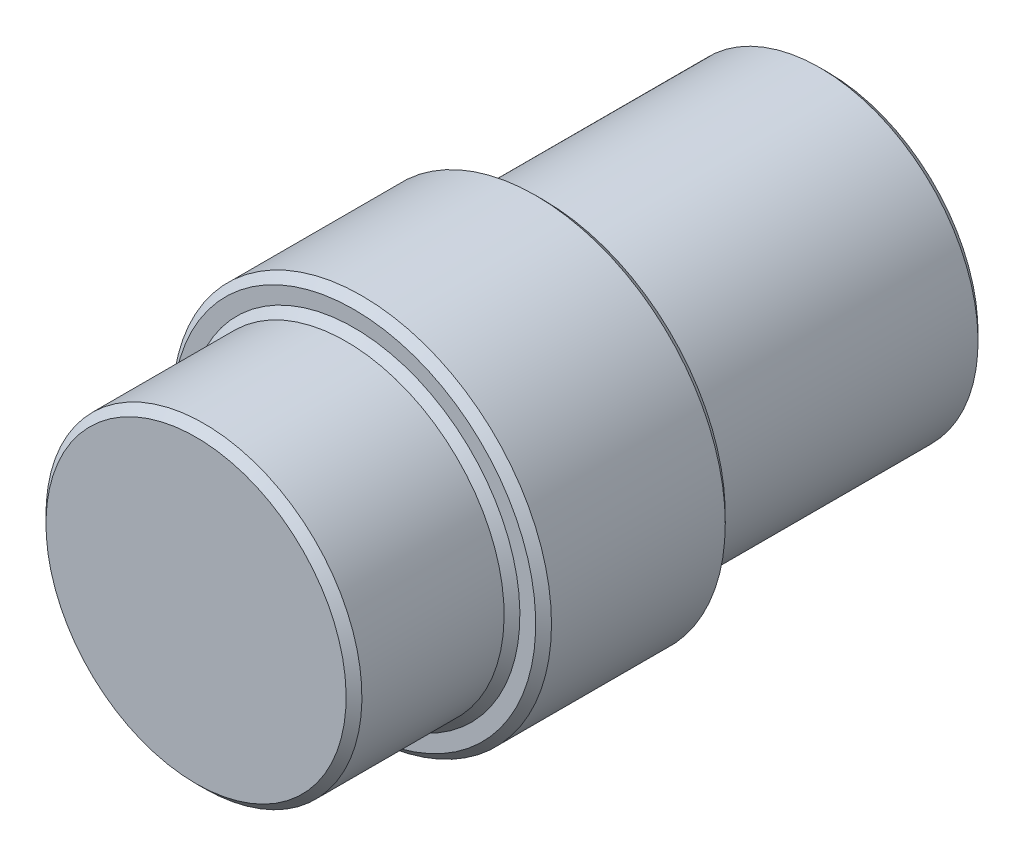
SolidWorks part; units mm, degrees
ref_plane "Спереди" through (0, 0, 0) normal (0, 0, 1) x (1, 0, 0)
ref_plane "Сверху" through (0, 0, 0) normal (0, 1, 0) x (1, 0, 0)
ref_plane "Справа" through (0, 0, 0) normal (1, 0, 0) x (0, 0, -1)
sketch "Эскиз1" plane through (0, 0, 0) normal (1, 0, 0) x (0, 0, -1)
  line L0 (0, 0) -> (0, 10)
  line L1 (0, 10) -> (10, 10)
  line L2 (10, 10) -> (10, 12)
  line L3 (10, 12) -> (22, 12)
  line L4 (22, 12) -> (22, 10)
  line L5 (22, 10) -> (40, 10)
  line L6 (40, 10) -> (40, 0)
  line L7 (40, 0) -> (0, 0)
  dimension "D1" = 10
  dimension "D2" = 12
  dimension "D3" = 10
  dimension "D4" = 12
  dimension "D5" = 18
revolve "Повернуть1" add sketch "Эскиз1" angle 360 about L7
chamfer "Фаска1" distance 0.5 angle 45 6 edges at (0, 12, -22) (0, 12, -10) (0, 10, -40) (0, 10, -22) (0, 10, -10) (0, 10, 0)
